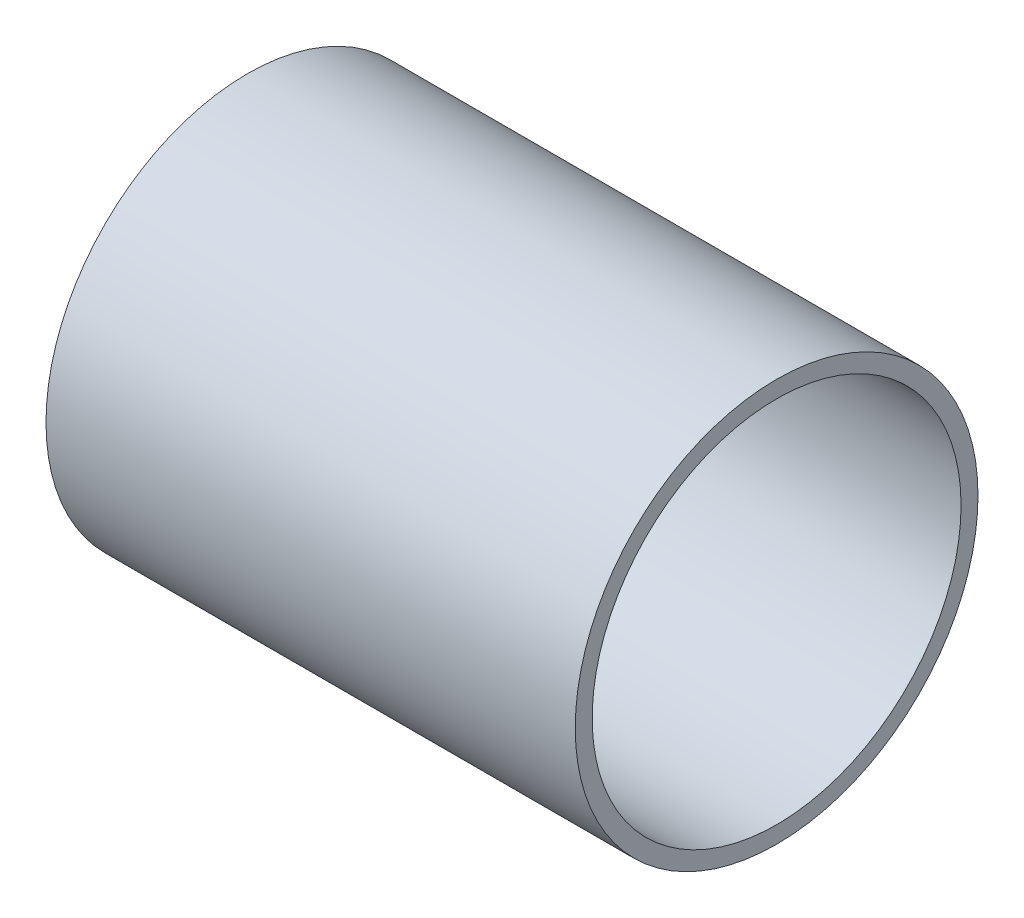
SolidWorks part; units mm, degrees
ref_plane "Plan de face" through (0, 0, 0) normal (0, 0, 1) x (1, 0, 0)
ref_plane "Plan de dessus" through (0, 0, 0) normal (0, 1, 0) x (1, 0, 0)
ref_plane "Plan de droite" through (0, 0, 0) normal (1, 0, 0) x (0, 0, -1)
sketch "Esquisse1" plane through (0, 0, 0) normal (0, 0, 1) x (1, 0, 0)
  line L0 (0, 0) -> (100, 0)
  dimension "D1" = 100
ref_plane "Plan1" through (0, 0, 0) normal (1, 0, 0) x (0, 0, -1)
sketch "Esquisse2" plane through (0, 0, 0) normal (1, 0, 0) x (0, 0, -1)
  circle A0 centre (0, 0) radius 38.05
  circle A1 centre (0, 0) radius 34.85
  dimension "D1" = 76.1
  dimension "D2" = 3.2
sweep "Balayage1" add profiles "Esquisse2" path "Esquisse1"
